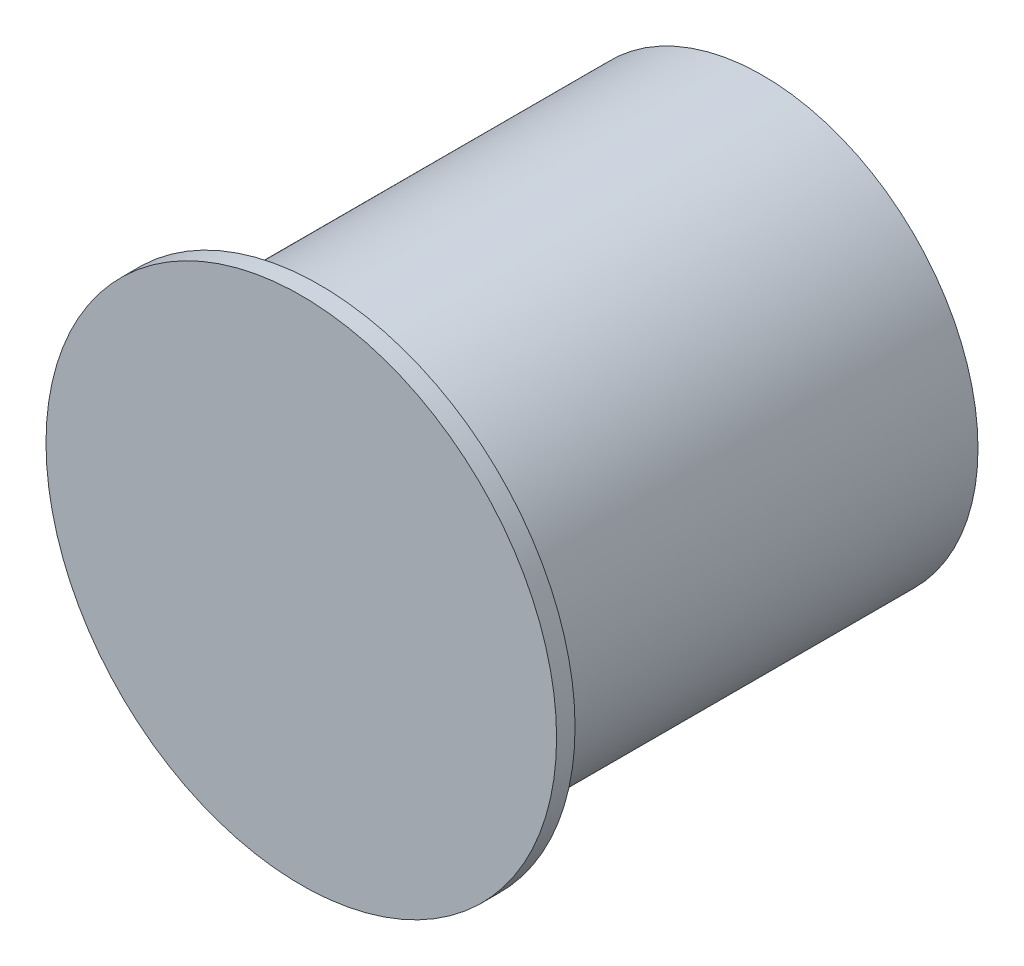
SolidWorks part; units mm, degrees
other "<94180A333_Brass Tapered Heat-Set Inserts for Plastic>-<CirPattern1>"
other "spool-cap"
other "large-roll-spacer"
other "spool-holder" parameters "D5"=4
other "Exploded View1" [suppressed]
other "Explode Step1" [suppressed]
other "Explode Line1"
other "Explode Step2" [suppressed]
other "Explode Line1"
ref_plane "XY Front Plane" through (0, 0, 0) normal (0, 0, 1) x (1, 0, 0)
ref_plane "ZX Top Plane" through (0, 0, 0) normal (0, 1, 0) x (1, 0, 0)
ref_plane "YZ Right Plane" through (0, 0, 0) normal (1, 0, 0) x (0, 0, -1)
imported_body "Surface-Imported1"
imported_body "Surface-Imported2"
imported_body "Surface-Imported3"
imported_body "Surface-Imported4"
imported_body "Surface-Imported5"
imported_body "Surface-Imported6"
imported_body "Surface-Imported7"
imported_body "Surface-Imported8"
imported_body "Surface-Imported9"
imported_body "Surface-Imported10"
imported_body "Surface-Imported11"
imported_body "Surface-Imported12"
imported_body "Surface-Imported13"
imported_body "Surface-Imported14"
imported_body "Surface-Imported15"
imported_body "Surface-Imported16"
imported_body "Surface-Imported17"
imported_body "Surface-Imported18"
imported_body "Surface-Imported19"
imported_body "Surface-Imported20"
imported_body "Surface-Imported21"
imported_body "Surface-Imported22"
imported_body "Surface-Imported23"
imported_body "Surface-Imported24"
imported_body "Surface-Imported25"
imported_body "Surface-Imported26"
imported_body "Surface-Imported27"
imported_body "Surface-Imported28"
imported_body "Surface-Imported29"
imported_body "Surface-Imported30"
imported_body "Surface-Imported31"
imported_body "Surface-Imported32"
imported_body "Surface-Imported33"
imported_body "Surface-Imported34"
imported_body "Surface-Imported35"
imported_body "Surface-Imported36"
imported_body "Surface-Imported37"
imported_body "Surface-Imported38"
imported_body "Surface-Imported39"
imported_body "Surface-Imported40"
imported_body "Surface-Imported41"
imported_body "Surface-Imported42"
imported_body "Surface-Imported43"
imported_body "Surface-Imported44"
imported_body "Surface-Imported45"
imported_body "Surface-Imported46"
imported_body "Surface-Imported47"
imported_body "Surface-Imported48"
imported_body "Surface-Imported49"
imported_body "Surface-Imported50"
imported_body "Surface-Imported51"
imported_body "Surface-Imported52"
imported_body "Surface-Imported53"
imported_body "Surface-Imported54"
imported_body "Surface-Imported55"
imported_body "Surface-Imported56"
imported_body "Surface-Imported57"
imported_body "Surface-Imported58"
sketch "Sketch1" plane through (0, 0, 0) normal (0, 0, 1) x (1, 0, 0)
  line L0 (149.9995, 110.0154) -> (105.1093, 110.0154) construction
  line L1 (127.5544, 132.5282) -> (127.5544, 87.5026) construction
  point P4 (127.5544, 110.0154)
ref_plane "Right_Plane" through (127.5544, 0, 0) normal (-1, 0, 0) x (0, -1, 0)
ref_plane "Top-Plane" through (0, 110.0154, 0) normal (0, 1, 0) x (-1, 0, 0)
sketch "Sketch2" plane through (0, 0, 0) normal (0, 0, 1) x (1, 0, 0)
  circle A0 centre (127.5544, 110.0154) radius 25
  dimension "D1" = 50
extrude "Boss-Extrude1" add sketch "Sketch2" along normal blind 72
sketch "Sketch3" plane through (0, 0, 0) normal (0, 0, 1) x (1, 0, 0)
  line L0 (149.9995, 110.0154) -> (105.1093, 110.0154) construction
  line L1 (127.5544, 110.0154) -> (140.5544, 123.0154) construction
  circle A0 centre (140.5544, 123.0154) radius 2.21
  circle A1 centre (127.5544, 110.0154) radius 18.3848 construction
  circle A2 centre (140.5544, 97.0154) radius 2.21
  circle A3 centre (114.5544, 97.0154) radius 2.21
  circle A4 centre (114.5544, 123.0154) radius 2.21
  point P0 (127.5544, 110.0154)
  point P17 (127.5544, 110.0154)
  dimension "D1" = 4.4199
  dimension "D2" = 26
  dimension "D3" = 45
  dimension "D4" = 4
sketch "Sketch4" plane through (0, 0, 0) normal (0, 0, 1) x (1, 0, 0)
  circle A1 centre (127.5544, 110.0154) radius 35
  circle A2 centre (127.5544, 110.0154) radius 25.6
  circle A3 centre (127.5544, 110.0154) radius 25.6
  dimension "D2" = 70
  dimension "D1" = 0.6
extrude "Boss-Extrude2" add sketch "Sketch4" along normal up to surface (72 mm away) separate body
sketch "Sketch5" plane through (0, 0, 72) normal (0, 0, 1) x (1, 0, 0)
  circle A0 centre (127.5544, 110.0154) radius 41.5
  dimension "D1" = 83
extrude "Boss-Extrude3" add sketch "Sketch5" along normal blind 3 separate body
sketch "Sketch6" plane through (127.5544, 0, 0) normal (-1, 0, 0) x (0, -1, 0)
  line L0 (-151.5154, 72) -> (-68.5154, 72) construction
  line L1 (-121.5154, 72) -> (-110.0154, 72)
  line L2 (-110.0154, 0) -> (-110.0154, 84.85) construction
  line L3 (-110.0154, 24.6896) -> (-110.0154, -24.6896) construction
  line L4 (-121.5154, 72) -> (-121.5154, 68.5)
  line L5 (-121.5154, 68.5) -> (-122.7654, 67.25)
  line L6 (-122.7654, 67.25) -> (-122.7654, 64.25)
  line L8 (-119.0154, 48) -> (-110.0154, 48)
  line L9 (-110.0154, 48) -> (-110.0154, 72)
  line L10 (-122.7654, 65.75) -> (-119.7661, 65.75) construction
  line L11 (-122.7654, 64.25) -> (-121.5154, 63)
  line L12 (-121.5154, 63) -> (-121.5154, 50.5)
  line L13 (-121.5154, 50.5) -> (-119.0154, 48)
  dimension "D1" = 23
  dimension "D2" = 24
  dimension "D3" = 1.25
  dimension "D4" = 45
  dimension "D5" = 3
  dimension "D6" = 18
  dimension "D7" = 3.5
  dimension "D8" = 45
revolve "Revolve1" add sketch "Sketch6" angle 360 about L2
sketch "Sketch7" plane through (127.5544, 0, 0) normal (-1, 0, 0) x (0, -1, 0)
  line L4 (-110.0154, 0) -> (-110.0154, 84.85) construction
  line L5 (-110.0154, 44.694) -> (-110.0154, 72)
  line L6 (-121.5154, 72) -> (-110.0154, 72)
  line L7 (-117.5154, 44.694) -> (-110.0154, 44.694)
  line L19 (-121.5154, 48.694) -> (-117.5154, 44.694)
  line L29 (-121.5154, 62.7929) -> (-121.5154, 48.694)
  line L30 (-122.7654, 64.0429) -> (-121.5154, 62.7929)
  line L31 (-122.7654, 67.4571) -> (-122.7654, 64.0429)
  line L32 (-121.5154, 68.7071) -> (-122.7654, 67.4571)
  line L33 (-121.5154, 72) -> (-121.5154, 68.7071)
  point P1 (-121.5154, 44.694)
  dimension "D2" = 27.306
revolve "Cut-Revolve1" cut sketch "Sketch7" angle 360 about L2
sketch "Sketch9" plane through (127.5544, 0, 0) normal (1, 0, 0) x (0, 0, -1)
  line L0 (-72, 135.0154) -> (-72, 85.0154) construction
  line L1 (-72, 128.0154) -> (-44.694, 128.0154)
  line L2 (-72, 128.0154) -> (-72, 125.0154)
  line L3 (-72, 125.0154) -> (-44.694, 125.0154)
  line L4 (-44.694, 128.0154) -> (-44.694, 125.0154)
  line L6 (0, 110.0154) -> (-84.85, 110.0154) construction
  line L7 (0, 110.0154) -> (-84.85, 110.0154) construction
  line L9 (-44.694, 117.5154) -> (-44.694, 102.5154) construction
  dimension "D1" = 3
  dimension "D2" = 30
revolve "Cut-Revolve2" cut sketch "Sketch9" angle 360 about L7
fillet "Fillet1" radius 2 2 edges at (112.5544, 110.0154, 44.694) (116.0544, 110.0154, 48.694)
sketch "Sketch10" plane through (0, 0, 72) normal (0, 0, 1) x (1, 0, 0)
  line L1 (159.4911, 105.0154) -> (95.6176, 105.0154)
  line L2 (159.4911, 105.0154) -> (159.4911, 115.0154)
  line L3 (159.4911, 115.0154) -> (95.6176, 115.0154)
  line L4 (95.6176, 105.0154) -> (95.6176, 115.0154)
  line L5 (127.5544, 115.0154) -> (127.5544, 105.0154) construction
  line L6 (159.4911, 110.0154) -> (95.6176, 110.0154) construction
  line L7 (132.5544, 81.7579) -> (122.5544, 81.7579)
  line L8 (132.5544, 81.7579) -> (132.5544, 138.2729)
  line L9 (132.5544, 138.2729) -> (122.5544, 138.2729)
  line L10 (122.5544, 81.7579) -> (122.5544, 138.2729)
  line L11 (127.5544, 138.2729) -> (127.5544, 81.7579) construction
  line L12 (132.5544, 110.0154) -> (122.5544, 110.0154) construction
  circle A0 centre (127.5544, 110.0154) radius 18 construction
  circle A1 centre (127.5544, 110.0154) radius 18
  point P0 (127.5544, 110.0154)
  point P4 (127.5544, 110.0154)
  dimension "D1" = 10
extrude "Cut-Extrude4" cut sketch "Sketch10" against normal up to surface (27.306 mm away) contours L3 L10 M9 | L10 L1 M9 | L8 L1 M9 | L8 L3 M9
sketch "Sketch13" plane through (0, 0, 0) normal (0, 0, -1) x (-1, 0, 0)
  line L0 (-127.5544, 110.0154) -> (-140.5544, 123.0154) construction
  line L1 (-149.9995, 110.0154) -> (-105.1093, 110.0154) construction
  line L2 (-127.5544, 110.0154) -> (-127.5544, 132.2952) construction
  line L3 (-127.5544, 132.5282) -> (-127.5544, 87.5026) construction
  line L4 (-127.5544, 110.0154) -> (-157.8659, 110.0154) construction
  circle A0 centre (-127.5544, 110.0154) radius 18.3848 construction
  point P0 (-140.5544, 123.0154)
  point P3 (-114.5544, 123.0154)
  point P6 (-140.5544, 97.0154)
  point P9 (-114.5544, 97.0154)
  dimension "D1" = 36.7696
  dimension "D2" = 45
hole_wizard "Ø4.0mm Dowel Hole1" positions "Sketch13" profile "Sketch12" hole size "Ø4.0" standard "ANSI Metric"
sketch "Sketch12" plane through (140.5544, 123.0154, 0) normal (1, 0, 0) x (0, 1, 0)
  line L0 (0, 0) -> (0, 9.6)
  line L1 (0, 9.6) -> (2.375, 8.173)
  line L2 (2.375, 8.173) -> (2.375, 0.8)
  line L3 (2.375, 0.8) -> (3.175, 0)
  line L5 (3.175, 0) -> (0, 0)
  line L6 (-2.375, 0.8) -> (-3.175, 0) construction
  line L10 (0, 9.6) -> (-2.375, 8.173) construction
  line L11 (0, -6.35) -> (0, 107.95) construction
  dimension "Hole Dia." = 4.75
  dimension "Hole Depth" = 9.6
  dimension "Near C'Sink Dia." = 6.35
  dimension "Near C'Sink Angle" = 90
  dimension "Drill Angle" = 118
other "Move Face1" parameters "D1"=0.2
inserted part "246R71-grainger-.375 ID x .375 flange bushing"
inserted part "94180A333_Brass Tapered Heat-Set Inserts for Plastic"
move or copy body "Body-Move/Copy4" placed by mates yes parameters "D1"=0, "D2"=0, "D3"=0
pattern_circular "CirPattern1" count 4 over 360 about axis through (127.5544, 110.0154, 170.9949) along (0, 0, -1)
move or copy body "Body-Move/Copy1" [suppressed] bodies to move or copy 172 copy no translate (0, 0, 150.1673) parameters "D1"=0, "D2"=0, "D3"=0
move or copy body "Body-Move/Copy2" [suppressed] bodies to move or copy 165 copy no translate (0, 0, 92.8824) parameters "D1"=0, "D2"=0, "D3"=0
